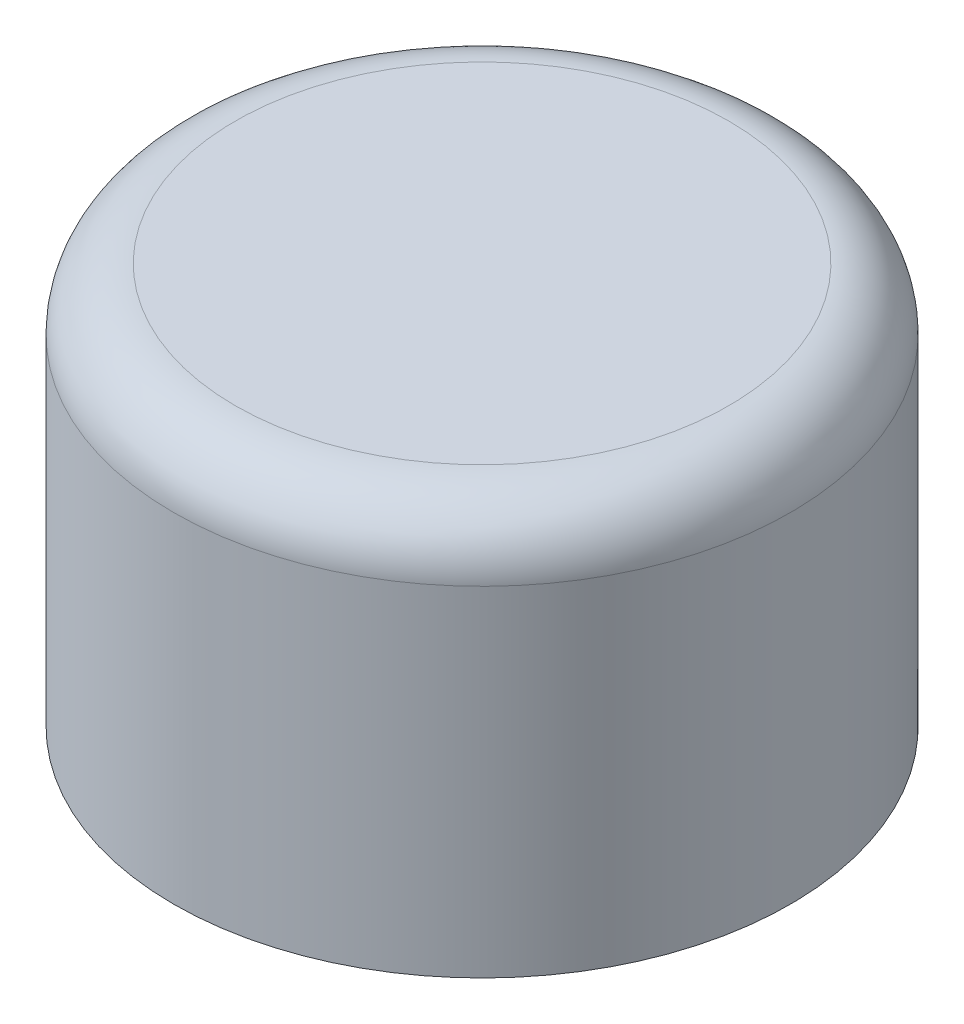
SolidWorks part; units mm, degrees
ref_plane "Ebene vorne" through (0, 0, 0) normal (0, 0, 1) x (1, 0, 0)
ref_plane "Ebene oben" through (0, 0, 0) normal (0, 1, 0) x (1, 0, 0)
ref_plane "Ebene rechts" through (0, 0, 0) normal (1, 0, 0) x (0, 0, -1)
sketch "Skizze1" plane through (0, 0, 0) normal (0, 1, 0) x (1, 0, 0)
  circle A0 centre (0, 0) radius 10
  dimension "D1" = 20
extrude "Aufsatz-Linear austragen1" add sketch "Skizze1" along normal blind 13
fillet "Verrundung1" radius 2 1 edges at (0, 13, 10)
